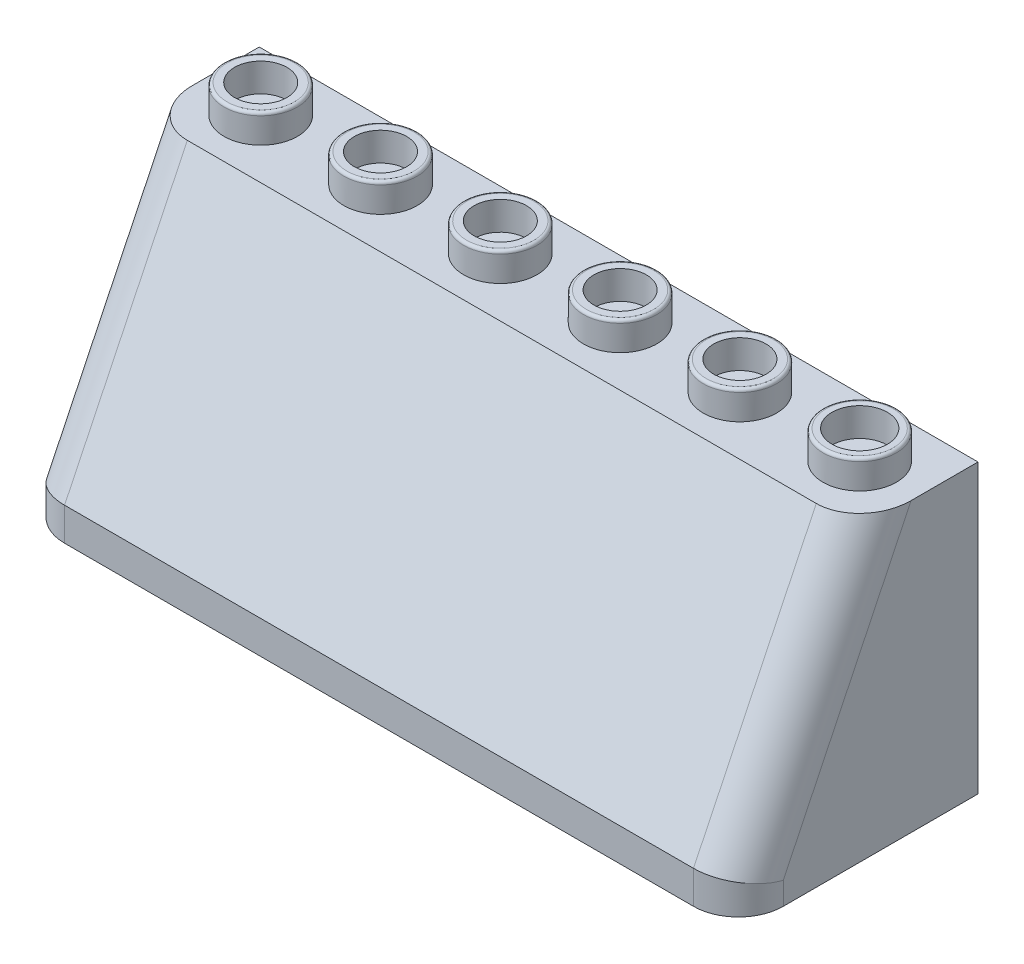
SolidWorks part; units mm, degrees
ref_plane "Vorne" through (0, 0, 0) normal (0, 0, 1) x (1, 0, 0)
ref_plane "Oben" through (0, 0, 0) normal (0, 1, 0) x (1, 0, 0)
ref_plane "Rechts" through (0, 0, 0) normal (1, 0, 0) x (0, 0, -1)
sketch "Skizze1" plane through (0, 0, 0) normal (0, 0, 1) x (1, 0, 0)
  line L1 (0, 0) -> (48, 0)
  line L2 (0, 0) -> (0, 19.2)
  line L3 (0, 19.2) -> (48, 19.2)
  line L4 (48, 0) -> (48, 19.2)
  dimension "D1" = 48
  dimension "D2" = 19.2
extrude "Linear austragen1" add sketch "Skizze1" along normal blind 16
sketch "Skizze2" plane through (48, 0, 0) normal (1, 0, 0) x (0, 0, -1)
  line L0 (-7.8, 19.2) -> (-16, 2.2)
  line L1 (-16, 19.2) -> (0, 19.2) construction
  line L2 (-16, 0) -> (-16, 19.2) construction
  line L3 (-16, 2.2) -> (-16, 19.2)
  line L4 (-16, 19.2) -> (-7.8, 19.2)
  line L5 (-16, 0) -> (0, 0) construction
  dimension "D1" = 2.2
  dimension "D2" = 7.8
extrude "Schnitt-Linear austragen1" cut sketch "Skizze2" against normal through all
fillet "Verrundung1" radius 3 4 edges at (48, 1.1, 16) (0, 1.1, 16) (0, 10.7, 11.9) (48, 10.7, 11.9)
sketch "Skizze4" plane through (0, 19.2, 0) normal (0, 1, 0) x (-1, 0, 0)
  line L0 (-42.15, 0) -> (-42.15, 7.8) construction
  line L1 (-48, 0) -> (0, 0) construction
  line L2 (-3, 7.8) -> (-45, 7.8) construction
  line L3 (-42.15, 3.9) -> (1.0563, 3.9) construction
  line L4 (-42.15, 3.9) -> (-49.4018, 3.9) construction
  line L5 (0, 4.4692) -> (0, 0) construction
  circle A0 centre (-44, 3.9) radius 2.45
  circle A1 centre (-36, 3.9) radius 2.45
  circle A2 centre (-28, 3.9) radius 2.45
  circle A3 centre (-20, 3.9) radius 2.45
  circle A4 centre (-12, 3.9) radius 2.45
  circle A5 centre (-4, 3.9) radius 2.45
  circle A6 centre (-36, 3.9) radius 1.75
  circle A7 centre (-28, 3.9) radius 1.75
  circle A8 centre (-20, 3.9) radius 1.75
  circle A9 centre (-12, 3.9) radius 1.75
  circle A10 centre (-4, 3.9) radius 1.75
  circle A11 centre (-44, 3.9) radius 1.85
  dimension "D7" = 4.9
  dimension "D8" = 3.5
  dimension "D9" = 4.9
  dimension "D10" = 3.5
  dimension "D11" = 4.9
  dimension "D12" = 3.5
  dimension "D13" = 4.9
  dimension "D14" = 3.5
  dimension "D15" = 4.9
  dimension "D16" = 3.5
  dimension "D17" = 4.9
  dimension "D18" = 3.7
  dimension "D1" = 8
  dimension "D2" = 8
  dimension "D3" = 8
  dimension "D4" = 8
  dimension "D5" = 8
  dimension "D6" = 4
extrude "Linear austragen2" add sketch "Skizze4" along normal blind 1.9
fillet "Verrundung2" radius 0.2 6 edges at (44, 21.1, 6.35) (36, 21.1, 6.35) (28, 21.1, 6.35) (20, 21.1, 6.35) (12, 21.1, 6.35) (4, 21.1, 6.35)
sketch "Skizze5" plane through (0, 0, 0) normal (-1, 0, 0) x (0, 0, 1)
  line L0 (0, 3.2) -> (13.8459, 3.2)
  line L1 (0, 19.2) -> (0, 0) construction
  line L2 (13.8459, 3.2) -> (6.9, 17.6)
  line L3 (6.9, 17.6) -> (0, 17.6)
  line L4 (0, 17.6) -> (0, 3.2)
  line L5 (13, 0) -> (0, 0) construction
  line L7 (4.4692, 19.2) -> (0, 19.2) construction
  line L8 (7.8, 19.2) -> (16, 2.2) construction
  dimension "D1" = 3.2
  dimension "D2" = 1.6
  dimension "D3" = 6.9
extrude "Schnitt-Linear austragen2" cut sketch "Skizze5" against normal blind 44.8 from offset 1.6
sketch "Skizze6" plane through (0, 0, 0) normal (0, -1, 0) x (1, 0, 0)
  line L0 (0, 0) -> (48, 0) construction
  line L1 (40, 0) -> (8, 0)
  line L2 (40, 0) -> (40, 8)
  line L3 (40, 8) -> (8, 8)
  line L4 (8, 0) -> (8, 8)
  line L5 (0, 13) -> (0, 0) construction
  line L6 (48, 13) -> (48, 0) construction
  line L7 (3, 16) -> (45, 16) construction
  dimension "D1" = 8
  dimension "D2" = 8
  dimension "D3" = 8
extrude "Schnitt-Linear austragen3" cut sketch "Skizze6" against normal blind 3.2
sketch "Skizze9" plane through (0, 0, 0) normal (0, -1, 0) x (1, 0, 0)
  line L0 (1.6, 1.6) -> (6.4, 1.6)
  line L1 (6.4, 1.6) -> (6.4, 9.6)
  line L2 (6.4, 9.6) -> (41.6, 9.6)
  line L3 (41.6, 9.6) -> (41.6, 1.6)
  line L4 (41.6, 1.6) -> (46.4, 1.6)
  line L5 (46.4, 1.6) -> (46.4, 14.4)
  line L6 (46.4, 14.4) -> (1.6, 14.4)
  line L7 (1.6, 14.4) -> (1.6, 1.6)
  line L8 (3, 16) -> (45, 16) construction
  line L9 (0, 0) -> (8, 0) construction
  line L10 (0, 13) -> (0, 0) construction
  line L11 (48, 13) -> (48, 0) construction
  line L12 (40, 8) -> (8, 8) construction
  line L13 (8, 8) -> (8, 0) construction
  line L14 (40, 0) -> (40, 8) construction
  dimension "D1" = 1.6
  dimension "D2" = 1.6
  dimension "D3" = 1.6
  dimension "D4" = 1.6
  dimension "D5" = 1.6
  dimension "D6" = 1.6
  dimension "D7" = 1.6
extrude "Schnitt-Linear austragen4" cut sketch "Skizze9" against normal blind 2.1
fillet "Verrundung3" radius 2.2 2 edges at (1.6, 1.05, 14.4) (46.4, 1.05, 14.4)
sketch "Skizze11" plane through (0, 2.1, 0) normal (0, -1, 0) x (1, 0, 0)
  line L0 (0, 13) -> (0, 0) construction
  line L2 (3, 16) -> (45, 16) construction
  line L3 (3, 16) -> (45, 16) construction
  line L4 (40, 0) -> (48, 0) construction
  line L5 (48, 13) -> (48, 0) construction
  circle A0 centre (24, 12) radius 1.6
  circle A1 centre (16, 12) radius 1.6
  circle A2 centre (8, 12) radius 1.6
  circle A3 centre (32, 12) radius 1.6
  circle A4 centre (40, 12) radius 1.6
  circle A5 centre (4, 8) radius 1.6
  circle A6 centre (44, 8) radius 1.6
  point P4 (24, 16)
  point P7 (44, 0)
  dimension "D1" = 4
  dimension "D7" = 3.2
  dimension "D8" = 3.2
  dimension "D12" = 3.2
  dimension "D13" = 3.2
  dimension "D14" = 3.2
  dimension "D15" = 3.2
  dimension "D16" = 3.2
  dimension "D2" = 8
  dimension "D3" = 4
  dimension "D4" = 4
  dimension "D5" = 4
  dimension "D6" = 4
  dimension "D9" = 4
  dimension "D10" = 8
  dimension "D11" = 4
  dimension "D17" = 8
  dimension "D18" = 8
  dimension "D19" = 8
  dimension "D20" = 8
  dimension "D21" = 8
extrude "Linear austragen3" add sketch "Skizze11" along normal blind 1.9
